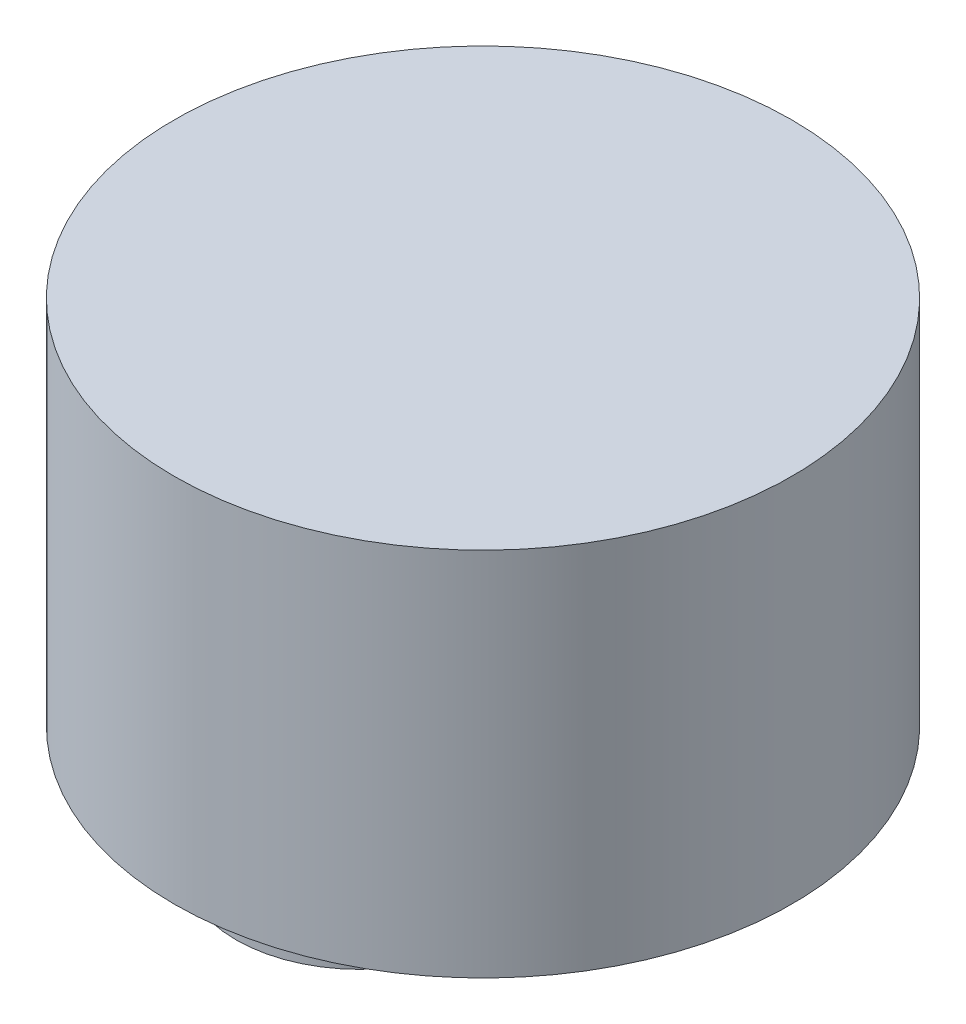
SolidWorks part; units mm, degrees
ref_plane "Front Plane" through (0, 0, 0) normal (0, 0, 1) x (1, 0, 0)
ref_plane "Top Plane" through (0, 0, 0) normal (0, 1, 0) x (1, 0, 0)
ref_plane "Right Plane" through (0, 0, 0) normal (1, 0, 0) x (0, 0, -1)
sketch "Sketch1" plane through (0, 0, 0) normal (0, 1, 0) x (1, 0, 0)
  circle A0 centre (0, 0) radius 2.5
  dimension "D1" = 5
extrude "Boss-Extrude1" add sketch "Sketch1" along normal blind 3
sketch "Sketch2" plane through (0, 0, 0) normal (0, -1, 0) x (1, 0, 0)
  circle A0 centre (-1, 0) radius 1
  dimension "D1" = 2
  dimension "D2" = 1
extrude "Boss-Extrude2" add sketch "Sketch2" along normal blind 1.5
sketch "Sketch3" plane through (0, 0, 0) normal (0, -1, 0) x (-1, 0, 0)
  line L0 (-2.5, 0) -> (2.5, 0) construction
  circle A0 centre (0, 0) radius 2.5 construction
